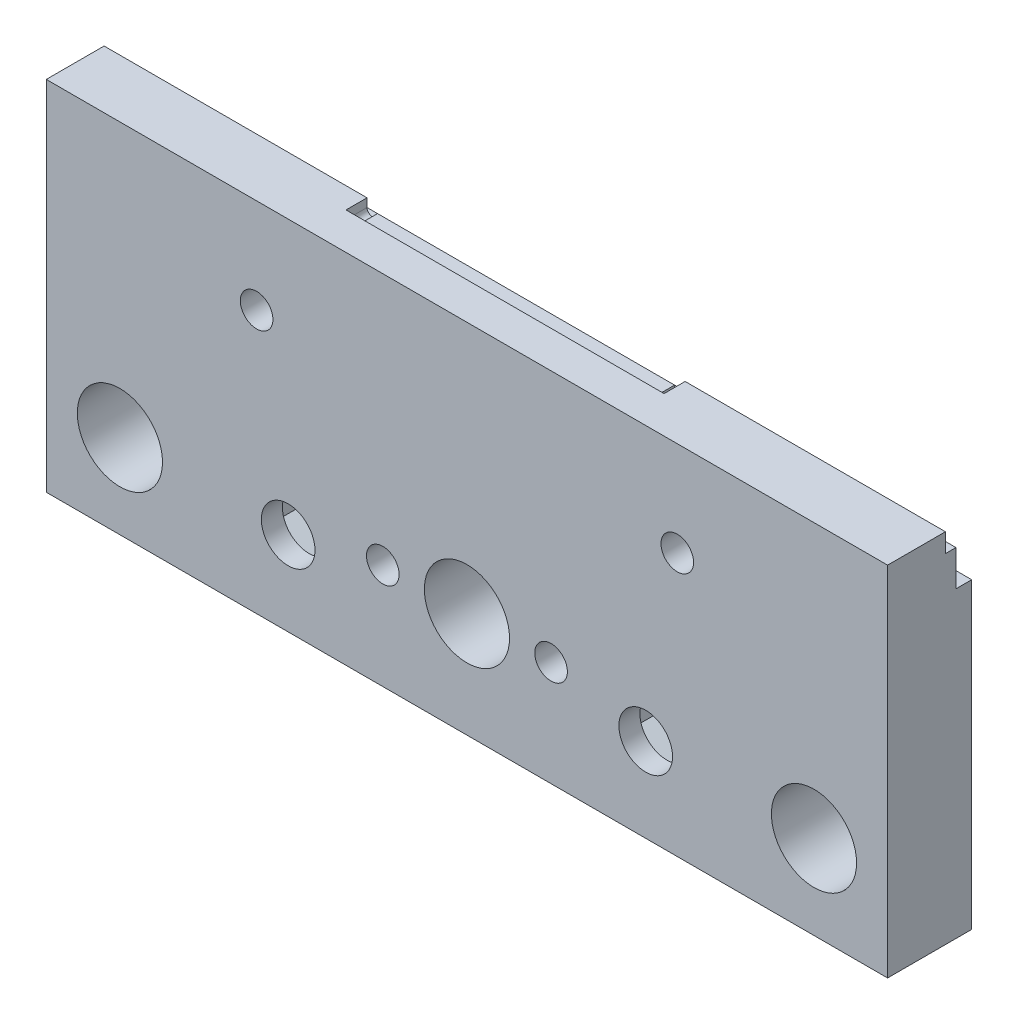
SolidWorks part; units mm, degrees
ref_plane "前视基准面" through (0, 0, 0) normal (0, 0, 1) x (1, 0, 0)
ref_plane "上视基准面" through (0, 0, 0) normal (0, 1, 0) x (1, 0, 0)
ref_plane "右视基准面" through (0, 0, 0) normal (1, 0, 0) x (0, 0, -1)
sketch "前视图草图" plane through (0, 0, 0) normal (0, 0, 1) x (1, 0, 0)
  line L0 (0, 0) -> (44.4821, 0) construction
  line L1 (0, 0) -> (0, 28.3185) construction
sketch "草图2" plane through (0, 0, 0) normal (0, 0, 1) x (1, 0, 0)
  line L0 (0, 0) -> (80, 0)
  line L1 (-200000, 0) -> (200044.4821, 0) construction
  line L2 (80, 0) -> (80, 34)
  line L3 (80, 34) -> (0, 34)
  line L4 (0, -200000) -> (0, 200028.3185) construction
  line L5 (0, 34) -> (0, 0)
  circle A0 centre (7, 8) radius 4.05
  circle A1 centre (40, 10) radius 4.05
  circle A2 centre (73, 8) radius 4.05
  dimension "D3" = 8
  dimension "D5" = 10
  dimension "D9" = 8.1
  dimension "D10" = 8.1
  dimension "D11" = 8.1
  dimension "D1" = 34
  dimension "D2" = 80
  dimension "D4" = 7
  dimension "D6" = 7
  dimension "D7" = 8
  dimension "D8" = 40
extrude "凸台-拉伸1" add sketch "草图2" along normal blind 8
sketch "草图3" plane through (0, 0, 8) normal (0, 0, 1) x (1, 0, 0)
  line L0 (16.088, 8) -> (31.4805, 8) construction
  line L1 (7, 8) -> (7, 16.8386) construction
  line L2 (73, 8) -> (73, 16.5917) construction
  line L4 (-200000, 0) -> (200044.4821, 0) construction
  circle A2 centre (23, 8) radius 2.55
  circle A3 centre (57, 8) radius 2.55
  dimension "D4" = 5.1
  dimension "D5" = 5.1
  dimension "D1" = 8
  dimension "D2" = 16
  dimension "D3" = 16
extrude "切除-拉伸1" cut sketch "草图3" against normal through all
sketch "草图4" plane through (80, 0, 0) normal (1, 0, 0) x (0, 0, -1)
  line L1 (0, -200000) -> (0, 200028.3185) construction
  line L2 (-1.5, 32.2) -> (-2.5, 32.2)
  line L3 (-2.5, 32.2) -> (-2.5, 34)
  line L4 (-8, 34) -> (0, 34) construction
  line L5 (-2.5, 34) -> (0, 34)
  line L6 (-1.5, 32.2) -> (-1.5, 28.8)
  line L7 (-1.5, 28.8) -> (0, 28.8)
  line L8 (0, 28.8) -> (0, 34)
  dimension "D1" = 3.4
  dimension "D2" = 2.5
  dimension "D3" = 1.5
  dimension "D4" = 1.8
extrude "切除-拉伸2" cut sketch "草图4" against normal through all
sketch "草图5" plane through (0, 0, 8) normal (0, 0, 1) x (1, 0, 0)
  line L0 (40, 10) -> (56.5376, 10) construction
  circle A0 centre (40, 10) radius 8 construction
  circle A1 centre (48, 10) radius 1.55
  circle A2 centre (32, 10) radius 1.55
  dimension "D1" = 3.1
  dimension "D2" = 3.1
  dimension "D3" = 16
extrude "切除-拉伸3" cut sketch "草图5" against normal through all
sketch "草图7" plane through (0, 0, 0) normal (0, 0, -1) x (-1, 0, 0)
  line L0 (-80, 0) -> (-80, 28.8) construction
  line L1 (-52.9, 5.6329) -> (-52.9, 10.3671)
  line L14 (-52.9, 10.3671) -> (-57, 12.7343)
  line L15 (-57, 12.7343) -> (-61.1, 10.3671)
  line L19 (-61.1, 10.3671) -> (-61.1, 5.6329)
  line L20 (-61.1, 5.6329) -> (-57, 3.2657)
  line L21 (-57, 3.2657) -> (-52.9, 5.6329)
  line L22 (-18.9, 5.6329) -> (-18.9, 10.3671)
  line L23 (-18.9, 10.3671) -> (-23, 12.7343)
  line L24 (-23, 12.7343) -> (-27.1, 10.3671)
  line L25 (-27.1, 10.3671) -> (-27.1, 5.6329)
  line L26 (-27.1, 5.6329) -> (-23, 3.2657)
  line L27 (-23, 3.2657) -> (-18.9, 5.6329)
  circle A6 centre (-57, 8) radius 4.1 construction
  circle A10 centre (-23, 8) radius 4.1 construction
  dimension "D1" = 8.2
sketch "草图8" plane through (0, 0, 0) normal (0, 0, -1) x (-1, 0, 0)
  line L0 (-80, 0) -> (-80, 28.8) construction
  line L1 (-45.15, 8.3546) -> (-45.15, 11.6454)
  line L5 (-45.15, 11.6454) -> (-48, 13.2909)
  line L6 (-48, 13.2909) -> (-50.85, 11.6454)
  line L7 (-50.85, 11.6454) -> (-50.85, 8.3546)
  line L8 (-50.85, 8.3546) -> (-48, 6.7091)
  line L9 (-48, 6.7091) -> (-45.15, 8.3546)
  line L10 (-29.15, 8.3546) -> (-29.15, 11.6454)
  line L11 (-29.15, 11.6454) -> (-32, 13.2909)
  line L12 (-32, 13.2909) -> (-34.85, 11.6454)
  line L13 (-34.85, 11.6454) -> (-34.85, 8.3546)
  line L14 (-34.85, 8.3546) -> (-32, 6.7091)
  line L15 (-32, 6.7091) -> (-29.15, 8.3546)
  circle A2 centre (-48, 10) radius 2.85 construction
  circle A3 centre (-32, 10) radius 2.85 construction
  dimension "D1" = 5.7
extrude "切除-拉伸5" cut sketch "草图8" against normal blind 4.5
sketch "草图11" plane through (0, 0, 0) normal (0, 0, -1) x (-1, 0, 0)
  line L0 (0, 34) -> (-80, 34) construction
  line L1 (-80, 0) -> (-80, 28.8) construction
  line L2 (0, -200000) -> (0, 200028.3185) construction
  line L3 (-40, 20) -> (-40, 13.5744) construction
  line L4 (-28.772, 25) -> (-45.9396, 25) construction
  circle A0 centre (-60, 25) radius 1.55
  circle A1 centre (-20, 25) radius 1.55
  point P23 (-40, 20)
  dimension "D1" = 3.1
  dimension "D2" = 3.1
  dimension "D3" = 20
  dimension "D4" = 20
  dimension "D5" = 9
sketch "草图20" plane through (0, 0, 0) normal (0, 0, -1) x (-1, 0, 0)
  circle A0 centre (-40, 10) radius 5.5
  dimension "D1" = 11
extrude "切除-拉伸7" cut sketch "草图11" against normal through all contours A0 | A1
sketch "草图12" plane through (0, 0, 0) normal (0, 0, -1) x (-1, 0, 0)
  line L0 (-62.5, 22.15) -> (-57.5, 22.15)
  line L1 (-57.5, 27.85) -> (-62.5, 27.85)
  line L4 (-80, 0) -> (-80, 28.8) construction
  line L5 (-39.1423, 25) -> (-43.2672, 25) construction
  line L6 (-60, 21) -> (-60, 25.2385) construction
  line L7 (-20, 21) -> (-20, 26.1603) construction
  line L8 (-40, 20) -> (-40, 24.3689) construction
  line L9 (-17.5, 27.85) -> (-22.5, 27.85)
  line L10 (-22.5, 22.15) -> (-17.5, 22.15)
  line L11 (0, -200000) -> (0, 200028.3185) construction
  line L12 (0, 34) -> (-80, 34) construction
  arc A0 (-62.5, 27.85) -> (-62.5, 22.15) centre (-62.5, 25) ccw
  arc A1 (-57.5, 22.15) -> (-57.5, 27.85) centre (-57.5, 25) ccw
  arc A4 (-17.5, 22.15) -> (-17.5, 27.85) centre (-17.5, 25) ccw
  arc A5 (-22.5, 27.85) -> (-22.5, 22.15) centre (-22.5, 25) ccw
  point P16 (-38, 21)
  point P28 (-40, 25)
  dimension "D2" = 20
  dimension "D3" = 5
  dimension "D4" = 2.5
  dimension "D5" = 20
  dimension "D6" = 9
  dimension "D1" = 2
sketch "草图19" plane through (0, 0, 2.5) normal (0, 0, -1) x (-1, 0, 0)
  line L0 (0, 34) -> (-80, 34) construction
  line L1 (-25, 34) -> (-55.2479, 34)
  line L2 (-25, 34) -> (-25, 33.2)
  line L3 (-26, 33.2) -> (-54.2479, 33.2)
  line L4 (-55.2479, 34) -> (-55.2479, 33.2)
  line L5 (0, -200000) -> (0, 200028.3185) construction
  line L7 (0, 32.2) -> (-80, 32.2) construction
  line L8 (-56.3335, 32.7) -> (-52.9089, 32.7) construction
  line L9 (-55.2479, 1028.5823) -> (-55.2479, 33.2) construction
  line L10 (-25, 1028.5823) -> (-25, 32.7) construction
  line L11 (-55.2479, 32.7) -> (-55.2479, -973.3) construction
  line L12 (-25, 32.7) -> (-25, -973.3) construction
  arc A3 (-55.2479, 33.2) -> (-54.2479, 33.2) centre (-54.7479, 33.2) ccw
  arc A6 (-26, 33.2) -> (-25, 33.2) centre (-25.5, 33.2) ccw
  dimension "D3" = 1
  dimension "D4" = 1
  dimension "D2" = 0.8
  dimension "D1" = 0.5
  dimension "D9" = 25
extrude "切除-拉伸11" cut sketch "草图19" against normal blind 2
extrude "切除-拉伸13" cut sketch "草图7" against normal blind 6
